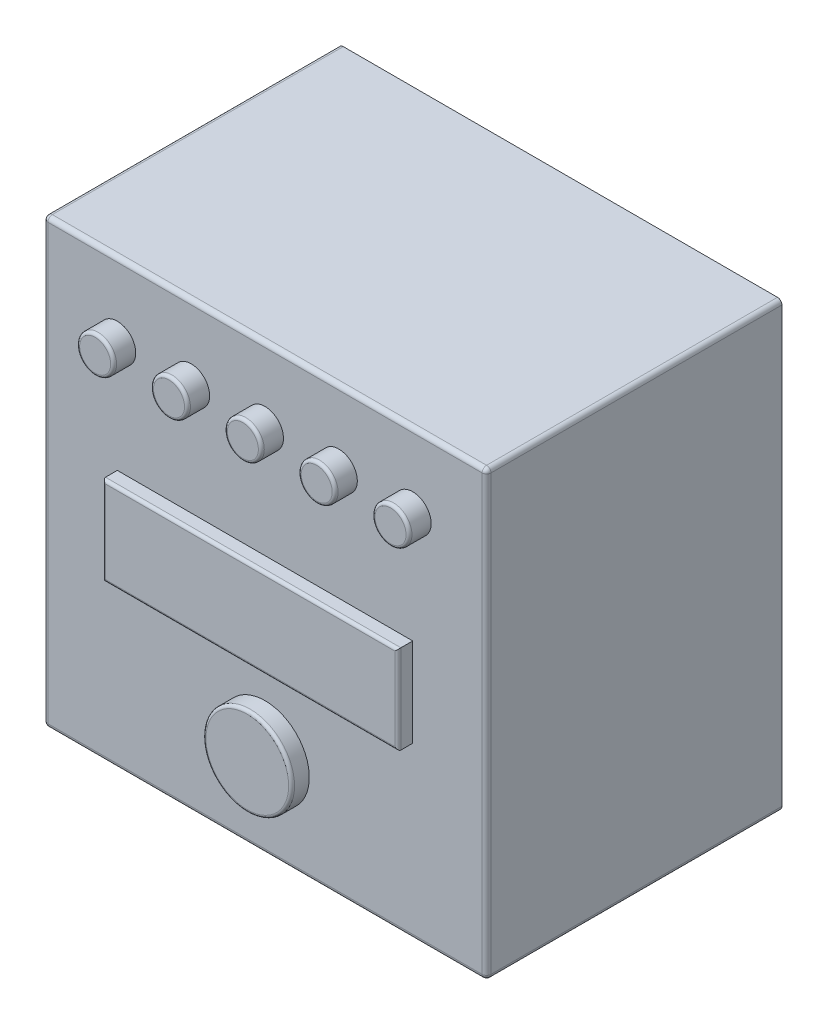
SolidWorks part; units mm, degrees
ref_plane "Face" through (0, 0, 0) normal (0, 0, 1) x (1, 0, 0)
ref_plane "Dessus" through (0, 0, 0) normal (0, 1, 0) x (1, 0, 0)
ref_plane "Droite" through (0, 0, 0) normal (1, 0, 0) x (0, 0, -1)
sketch "Esquisse1" plane through (0, 0, 0) normal (0, 0, 1) x (1, 0, 0)
  line L1 (0, 0) -> (300, 0)
  line L2 (0, 0) -> (0, 300)
  line L3 (0, 300) -> (300, 300)
  line L4 (300, 0) -> (300, 300)
  dimension "D1" = 300
  dimension "D2" = 300
extrude "Extrusion1" add sketch "Esquisse1" along normal blind 200
shell "Coque1" thickness 5
ref_plane "Plan1" through (100, 0, 0) normal (1, 0, 0) x (0, 0, -1)
sketch "Esquisse2" plane through (0, 0, 200) normal (0, 0, 1) x (1, 0, 0)
  line L0 (0, 300) -> (0, 0) construction
  line L2 (300, 300) -> (0, 300) construction
  circle A0 centre (50, 250) radius 12.5
  circle A1 centre (100, 250) radius 12.5
  circle A2 centre (200, 250) radius 12.5
  circle A3 centre (150, 250) radius 12.5
  circle A6 centre (250, 250) radius 12.5
  dimension "D1" = 50
  dimension "D2" = 50
  dimension "D3" = 50
  dimension "D4" = 50
  dimension "D5" = 50
  dimension "D6" = 25
  dimension "D8" = 25
  dimension "D10" = 25
  dimension "D11" = 50
extrude "Extrusion2" add sketch "Esquisse2" along normal blind 15
fillet "Congé1" radius 2 5 edges at (62.5, 250, 215) (112.5, 250, 215) (162.5, 250, 215) (212.5, 250, 215) (262.5, 250, 215)
sketch "Esquisse3" plane through (0, 0, 200) normal (0, 0, 1) x (1, 0, 0)
  line L0 (300, 300) -> (0, 300) construction
  line L1 (50, 175) -> (250, 175)
  line L2 (50, 175) -> (50, 115)
  line L3 (50, 115) -> (250, 115)
  line L4 (250, 175) -> (250, 115)
  dimension "D1" = 60
  dimension "D2" = 125
extrude "Extrusion3" add sketch "Esquisse3" along normal blind 10
fillet "Congé2" radius 2 4 edges at (250, 145, 210) (150, 115, 210) (150, 175, 210) (50, 145, 210)
sketch "Esquisse4" plane through (0, 0, 200) normal (0, 0, 1) x (1, 0, 0)
  line L2 (0, 300) -> (0, 0) construction
  line L3 (0, 0) -> (300, 0) construction
  circle A0 centre (150, 60) radius 30
  dimension "D1" = 150
  dimension "D2" = 60
  dimension "D3" = 60
extrude "Extrusion4" add sketch "Esquisse4" along normal blind 12
fillet "Congé4" radius 3 8 edges at (0, 0, 100) (300, 0, 100) (150, 0, 200) (300, 150, 200) (300, 300, 100) (0, 300, 100) (150, 300, 200) (0, 150, 200)
fillet "Congé5" radius 2 1 edges at (180, 60, 212)
